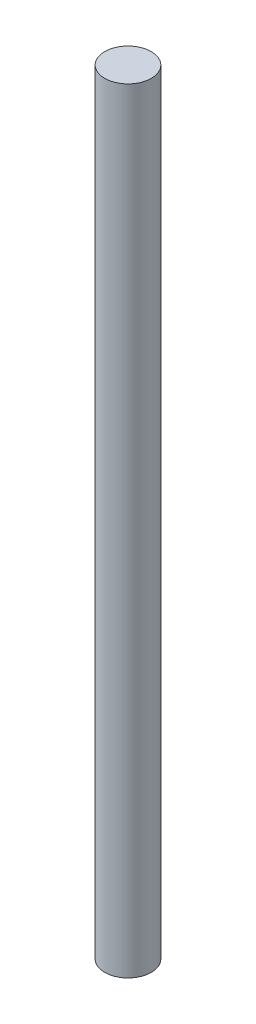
SolidWorks part; units mm, degrees
ref_plane "Front Plane" through (0, 0, 0) normal (0, 0, 1) x (1, 0, 0)
ref_plane "Top Plane" through (0, 0, 0) normal (0, 1, 0) x (1, 0, 0)
ref_plane "Right Plane" through (0, 0, 0) normal (1, 0, 0) x (0, 0, -1)
sketch "Sketch1" plane through (0, 0, 0) normal (0, 1, 0) x (1, 0, 0)
  circle A0 centre (0, 0) radius 3
extrude "Boss-Extrude1" add sketch "Sketch1" along normal blind 100
